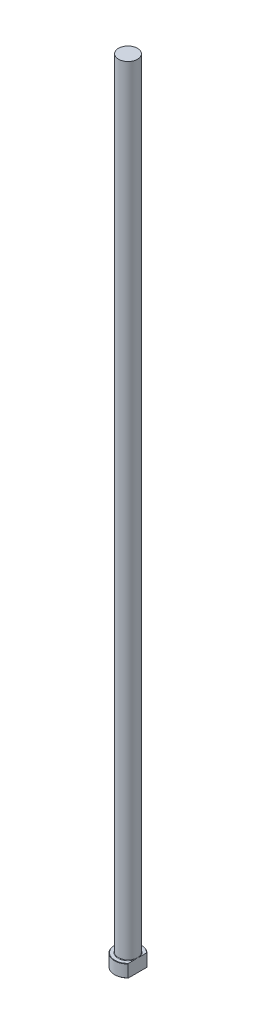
SolidWorks part; units mm, degrees
ref_plane "Front Plane" through (0, 0, 0) normal (0, 0, 1) x (1, 0, 0)
ref_plane "Top Plane" through (0, 0, 0) normal (0, 1, 0) x (1, 0, 0)
ref_plane "Right Plane" through (0, 0, 0) normal (1, 0, 0) x (0, 0, -1)
sketch "Sketch1" plane through (0, 0, 0) normal (0, 0, 1) x (1, 0, 0)
  line L0 (0, 259.9588) -> (0, -15.1925) construction
  line L1 (0, 0) -> (-8.5, 0)
  line L2 (-8.5, 0) -> (-8.5, 8)
  line L3 (-8.5, 8) -> (-6, 8)
  line L4 (-6, 8) -> (-6, 500)
  line L5 (-6, 500) -> (0, 500)
  line L6 (0, 500) -> (0, 0)
  dimension "L" = 500
  dimension "H" = 17
  dimension "T" = 8
  dimension "D" = 12
revolve "Revolve1" add sketch "Sketch1" angle 360 about L0
chamfer "Chamfer1" distance 0.2 angle 45 2 edges at (0, 8, 8.5) (0, 0, 8.5)
fillet "Fillet1" radius 0.3 1 edges at (0, 8, 6)
sketch "Sketch2" plane through (0, 0, 0) normal (0, 1, 0) x (1, 0, 0)
  line L0 (6, -6.0208) -> (6, 6.0208)
  circle A0 centre (0, 0) radius 8.5 construction
  arc A1 (6, -6.0208) -> (6, 6.0208) centre (0, 0) ccw
  circle A2 centre (0, 0) radius 6 construction
extrude "KEYED HEAD" cut sketch "Sketch2" along normal through all
